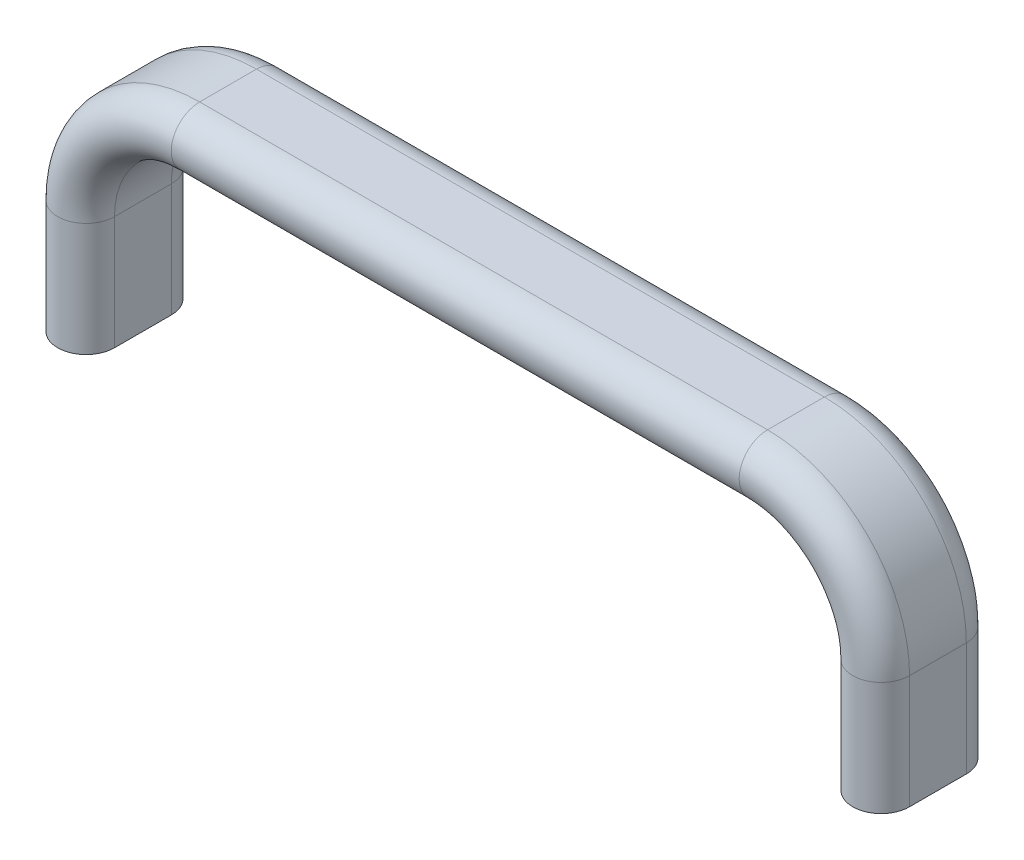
SolidWorks part; units mm, degrees
ref_plane "Front Plane" through (0, 0, 0) normal (0, 0, 1) x (1, 0, 0)
ref_plane "Top Plane" through (0, 0, 0) normal (0, 1, 0) x (1, 0, 0)
ref_plane "Right Plane" through (0, 0, 0) normal (1, 0, 0) x (0, 0, -1)
sketch "Sketch1" plane through (0, 0, 0) normal (0, 0, 1) x (1, 0, 0)
  line L0 (-70, 0) -> (-70, 20)
  line L1 (-50, 40) -> (50, 40)
  line L2 (0, 0) -> (0, 50000) construction
  line L3 (70, 0) -> (70, 20)
  arc A0 (-70, 20) -> (-50, 40) centre (-50, 20) cw
  arc A1 (70, 20) -> (50, 40) centre (50, 20) ccw
  point P9 (0, 40)
  dimension "D3" = 20
  dimension "D1" = 140
  dimension "D2" = 40
sketch "Sketch2" plane through (0, 0, 0) normal (0, 1, 0) x (1, 0, 0)
  line L0 (-75, -5) -> (-75, 5)
  line L1 (-65, 5) -> (-65, -5)
  line L2 (0, 0) -> (-50000, 0) construction
  line L3 (-70, -10) -> (-70, 10) construction
  arc A0 (-75, 5) -> (-65, 5) centre (-70, 5) cw
  arc A1 (-75, -5) -> (-65, -5) centre (-70, -5) ccw
  point P0 (-70, 10)
  point P6 (-75, 0)
  point P10 (-65, 0)
  point P11 (-70, -10)
  point P15 (-70, 0)
  dimension "D1" = 10
  dimension "D2" = 20
sweep "Sweep1" add profiles "Sketch2" path "Sketch1"
sketch "Sketch3" plane through (0, 0, 0) normal (0, -1, 0) x (1, 0, 0)
  circle A0 centre (-70, 0) radius 2.1
  dimension "D1" = 4.2
  dimension "D2" = 70
extrude "Extrude1" cut sketch "Sketch3" against normal blind 12.5
sketch "Sketch4" plane through (0, 0, 0) normal (0, -1, 0) x (1, 0, 0)
  circle A0 centre (-70, 0) radius 2.5
  dimension "D1" = 5
extrude "Extrude2" cut sketch "Sketch4" against normal blind 10
sketch "Sketch5" plane through (0, 0, 0) normal (0, 0, 1) x (1, 0, 0)
  line L0 (-70, 12.5) -> (-72.1, 12.5)
  line L1 (-72.1, 12.5) -> (-70, 13.7124)
  line L2 (-70, 13.7124) -> (-70, 12.5)
  dimension "D1" = 30
  dimension "D2" = 2.1
  dimension "D3" = 12.5
  dimension "D4" = 70
revolve "Cut-Revolve1" cut sketch "Sketch5" angle 360 about L2
mirror "Mirror1" about plane through (0, 0, 0) normal (1, 0, 0) of "Cut-Revolve1", "Extrude2", "Extrude1"
equation "\"D2@Sketch3\" = \"D1@Sketch1\"/2"
equation "\"D2@Sketch5\" = \"D1@Sketch3\"/2"
equation "\"D3@Sketch5\" = \"D1@Extrude1\""
equation "\"D4@Sketch5\" = \"D1@Sketch1\"/2"
